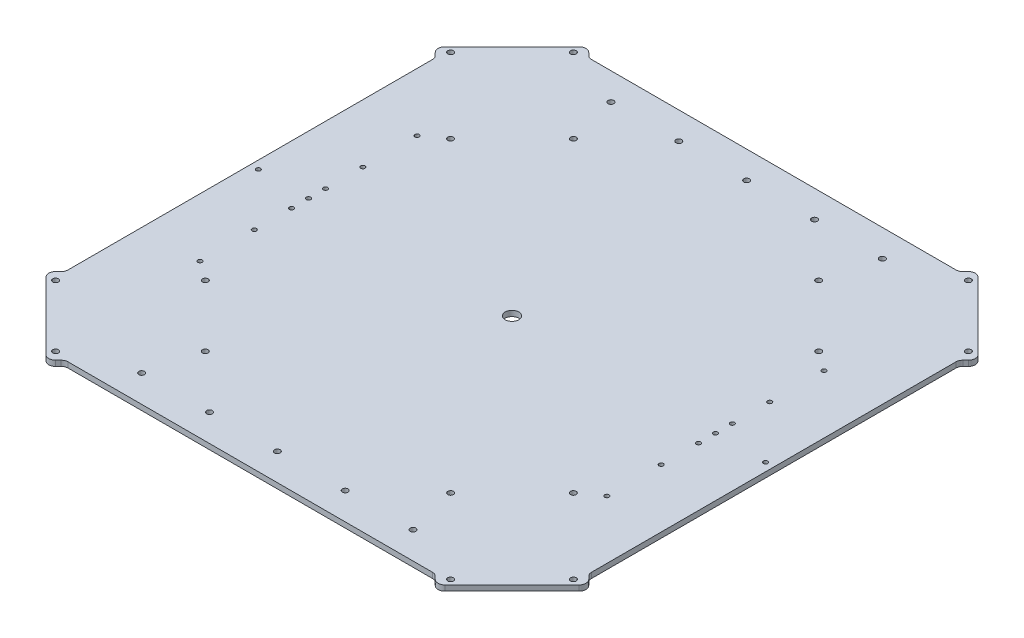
SolidWorks part; units mm, degrees
ref_plane "前视基准面" through (0, 0, 0) normal (0, 0, 1) x (1, 0, 0)
ref_plane "上视基准面" through (0, 0, 0) normal (0, 1, 0) x (1, 0, 0)
ref_plane "右视基准面" through (0, 0, 0) normal (1, 0, 0) x (0, 0, -1)
sketch "草图1" plane through (0, 0, 0) normal (0, 1, 0) x (1, 0, 0)
  line L0 (-143.4315, 200) -> (-200, 143.4315)
  line L1 (-200, 200) -> (200, 200)
  line L2 (-200, 200) -> (-200, -200)
  line L3 (-200, -200) -> (200, -200)
  line L4 (200, 200) -> (200, -200)
  line L5 (-200, 200) -> (200, -200) construction
  line L6 (-200, -200) -> (200, 200) construction
  line L7 (200, 143.4315) -> (143.4315, 200)
  line L8 (143.4315, -200) -> (200, -143.4315)
  line L9 (-200, -143.4315) -> (-143.4315, -200)
  point P17 (0, 0)
  dimension "D1" = 400
  dimension "D2" = 400
  dimension "D3" = 45
  dimension "D4" = 4
  dimension "D5" = 40
extrude "凸台-拉伸1" add sketch "草图1" along normal blind 4 contours L2 L9 L3 L8 L4 L7 L1 L0
sketch "草图2" plane through (0, 4, 0) normal (0, 1, 0) x (1, 0, 0)
  line L0 (-145.5528, 190.8076) -> (-190.8076, 145.5528) construction
  line L1 (-143.4315, 200) -> (-200, 143.4315) construction
  line L2 (-171.7157, 171.7157) -> (-94.1279, 94.1279) construction
  line L3 (-90.3984, 135.6533) -> (-135.6533, 90.3984) construction
  line L4 (190.8076, 145.5528) -> (145.5528, 190.8076) construction
  line L5 (171.7157, 171.7157) -> (94.1279, 94.1279) construction
  line L6 (135.6533, 90.3984) -> (90.3984, 135.6533) construction
  line L7 (145.5528, -190.8076) -> (190.8076, -145.5528) construction
  line L8 (171.7157, -171.7157) -> (94.1279, -94.1279) construction
  line L9 (90.3984, -135.6533) -> (135.6533, -90.3984) construction
  line L10 (-190.8076, -145.5528) -> (-145.5528, -190.8076) construction
  line L11 (-171.7157, -171.7157) -> (-94.1279, -94.1279) construction
  line L12 (-135.6533, -90.3984) -> (-90.3984, -135.6533) construction
  circle A0 centre (-190.8076, 145.5528) radius 2.1
  circle A1 centre (-145.5528, 190.8076) radius 2.1
  circle A2 centre (-135.6533, 90.3984) radius 2.1
  circle A3 centre (-90.3984, 135.6533) radius 2.1
  circle A4 centre (145.5528, 190.8076) radius 2.1
  circle A5 centre (190.8076, 145.5528) radius 2.1
  circle A6 centre (90.3984, 135.6533) radius 2.1
  circle A7 centre (135.6533, 90.3984) radius 2.1
  circle A8 centre (190.8076, -145.5528) radius 2.1
  circle A9 centre (145.5528, -190.8076) radius 2.1
  circle A10 centre (135.6533, -90.3984) radius 2.1
  circle A11 centre (90.3984, -135.6533) radius 2.1
  circle A12 centre (-145.5528, -190.8076) radius 2.1
  circle A13 centre (-190.8076, -145.5528) radius 2.1
  circle A14 centre (-90.3984, -135.6533) radius 2.1
  circle A15 centre (-135.6533, -90.3984) radius 2.1
  point P8 (-168.1802, 168.1802)
  point P46 (0, 0)
  dimension "D1" = 4.2
  dimension "D2" = 4.2
  dimension "D3" = 5
  dimension "D4" = 64
  dimension "D6" = 78
  dimension "D8" = 78
  dimension "D5" = 2
  dimension "D7" = 4
extrude "切除-拉伸1" cut sketch "草图2" against normal through all
sketch "草图3" plane through (0, 4, 0) normal (0, 1, 0) x (1, 0, 0)
  line L0 (-200, 143.4315) -> (-192.9289, 136.3604)
  line L1 (-192.9289, 136.3604) -> (-192.9289, -136.3604)
  line L2 (0, 0) -> (-200, 0) construction
  line L3 (-200, 143.4315) -> (-200, -143.4315) construction
  line L4 (-200, -143.4315) -> (-192.9289, -136.3604)
  line L5 (143.4315, 200) -> (136.3604, 192.9289)
  line L6 (136.3604, 192.9289) -> (-136.3604, 192.9289)
  line L7 (-143.4315, 200) -> (-136.3604, 192.9289)
  line L8 (200, -143.4315) -> (192.9289, -136.3604)
  line L9 (192.9289, -136.3604) -> (192.9289, 136.3604)
  line L10 (200, 143.4315) -> (192.9289, 136.3604)
  line L11 (-143.4315, -200) -> (-136.3604, -192.9289)
  line L12 (-136.3604, -192.9289) -> (136.3604, -192.9289)
  line L13 (143.4315, -200) -> (136.3604, -192.9289)
  line L22 (-200, 143.4315) -> (-200, -143.4315)
  line L23 (-200, -143.4315) -> (-143.4315, -200)
  line L24 (-143.4315, -200) -> (143.4315, -200)
  line L25 (143.4315, -200) -> (200, -143.4315)
  line L26 (200, -143.4315) -> (200, 143.4315)
  line L27 (200, 143.4315) -> (143.4315, 200)
  line L28 (143.4315, 200) -> (-143.4315, 200)
  line L29 (-143.4315, 200) -> (-200, 143.4315)
  line L30 (-200, 143.4315) -> (-200, -143.4315)
  line L32 (-143.4315, -200) -> (143.4315, -200)
  line L34 (200, -143.4315) -> (200, 143.4315)
  line L36 (143.4315, 200) -> (-143.4315, 200)
  point P10 (-192.9289, 0)
  point P18 (0, 192.9289)
  point P23 (192.9289, 0)
  point P28 (0, -192.9289)
  point P29 (0, 0)
  dimension "D1" = 10
  dimension "D3" = 0
  dimension "D2" = 4
extrude "切除-拉伸2" cut sketch "草图3" against normal through all
sketch "草图4" plane through (0, 4, 0) normal (0, 1, 0) x (1, 0, 0)
  circle A0 centre (0, 0) radius 5
  dimension "D1" = 10
extrude "切除-拉伸3" cut sketch "草图4" against normal through all
sketch "草图5" plane through (0, 0, 0) normal (0, -1, 0) x (1, 0, 0)
  line L0 (0, 192.9289) -> (0, -192.9289) construction
  line L1 (136.3604, 192.9289) -> (-136.3604, 192.9289) construction
  line L2 (-136.3604, -192.9289) -> (136.3604, -192.9289) construction
  line L3 (192.9289, -136.3604) -> (192.9289, 136.3604) construction
  circle A0 centre (162.9289, 100) radius 16
  circle A1 centre (162.9289, -100) radius 16
  circle A2 centre (-162.9289, -100) radius 16
  circle A3 centre (-162.9289, 100) radius 16
  dimension "D1" = 32
  dimension "D2" = 32
  dimension "D3" = 200
  dimension "D4" = 30
extrude "切除-拉伸4" cut sketch "草图5" against normal through all
sketch "草图6" plane through (0, 0, 0) normal (0, -1, 0) x (1, 0, 0)
  line L1 (0, 192.9289) -> (0, -192.9289) construction
  line L2 (136.3604, 192.9289) -> (-136.3604, 192.9289) construction
  line L3 (-136.3604, -192.9289) -> (136.3604, -192.9289) construction
  circle A0 centre (-149.9289, 80) radius 1.6
  circle A10 centre (-162.9289, 100) radius 16 construction
  circle A11 centre (-149.9289, 40) radius 1.6
  circle A12 centre (-149.9289, 0) radius 1.6
  circle A13 centre (-149.9289, -40) radius 1.6
  circle A14 centre (-149.9289, -80) radius 1.6
  circle A15 centre (149.9289, -80) radius 1.6
  circle A16 centre (149.9289, -40) radius 1.6
  circle A17 centre (149.9289, 0) radius 1.6
  circle A18 centre (149.9289, 40) radius 1.6
  circle A19 centre (149.9289, 80) radius 1.6
  dimension "D1" = 3.2
  dimension "D2" = 20
  dimension "D3" = 13
  dimension "D4" = 5
extrude "切除-拉伸5" cut sketch "草图6" against normal through all
sketch "草图7" plane through (0, 4, 0) normal (0, 1, 0) x (1, 0, 0)
  line L0 (0, 192.9289) -> (0, -192.9289) construction
  line L1 (-136.3604, 192.9289) -> (136.3604, 192.9289) construction
  line L2 (136.3604, -192.9289) -> (-136.3604, -192.9289) construction
  line L3 (0, 0) -> (192.9289, 0) construction
  line L4 (192.9289, 136.3604) -> (192.9289, -136.3604) construction
  circle A0 centre (0, 172.9289) radius 2.1
  circle A1 centre (50, 172.9289) radius 2.1
  circle A2 centre (100, 172.9289) radius 2.1
  circle A3 centre (-100, 172.9289) radius 2.1
  circle A4 centre (-50, 172.9289) radius 2.1
  circle A5 centre (-50, -172.9289) radius 2.1
  circle A6 centre (-100, -172.9289) radius 2.1
  circle A7 centre (100, -172.9289) radius 2.1
  circle A8 centre (50, -172.9289) radius 2.1
  circle A9 centre (0, -172.9289) radius 2.1
  circle A11 centre (150, 172.9289) radius 2.1
  dimension "D1" = 4.2
  dimension "D2" = 20
  dimension "D3" = 4
extrude "切除-拉伸6" cut sketch "草图7" against normal through all
sketch "草图8" plane through (0, 4, 0) normal (0, 1, 0) x (1, 0, 0)
  circle A0 centre (-161.809, 100) radius 18.3436
  circle A1 centre (162.9289, 100) radius 16
  circle A2 centre (162.9289, -100) radius 18.7354
  circle A3 centre (-161.809, -100) radius 18.8764
extrude "凸台-拉伸2" add sketch "草图8" against normal up to surface (4 mm away)
sketch "草图9" plane through (0, 4, 0) normal (0, 1, 0) x (1, 0, 0)
  circle A0 centre (-149.9289, 12.5) radius 1.6
  circle A1 centre (-149.9289, -12.5) radius 1.6
  circle A2 centre (149.9289, 12.5) radius 1.6
  circle A3 centre (149.9289, -12.5) radius 1.6
extrude "切除-拉伸7" cut sketch "草图9" against normal blind 10
sketch "草图10" plane through (0, 4, 0) normal (0, 1, 0) x (1, 0, 0)
  line L0 (-192.9289, -136.3604) -> (-192.9289, 136.3604) construction
  line L1 (0, 0) -> (0, 48.8969) construction
  circle A0 centre (-186.9289, 0) radius 1.6
  circle A1 centre (186.9289, 0) radius 1.6
  dimension "D1" = 3.2
  dimension "D2" = 6
extrude "切除-拉伸8" cut sketch "草图10" against normal blind 10
fillet "圆角1" radius 5 16 edges at (-192.9289, 2, 136.3604) (-200, 2, 143.4315) (-143.4315, 2, 200) (-136.3604, 2, 192.9289) (136.3604, 2, 192.9289) (143.4315, 2, 200) (200, 2, 143.4315) (192.9289, 2, 136.3604) (192.9289, 2, -136.3604) (200, 2, -143.4315) (143.4315, 2, -200) (136.3604, 2, -192.9289) (-136.3604, 2, -192.9289) (-143.4315, 2, -200) (-200, 2, -143.4315) (-192.9289, 2, -136.3604)
